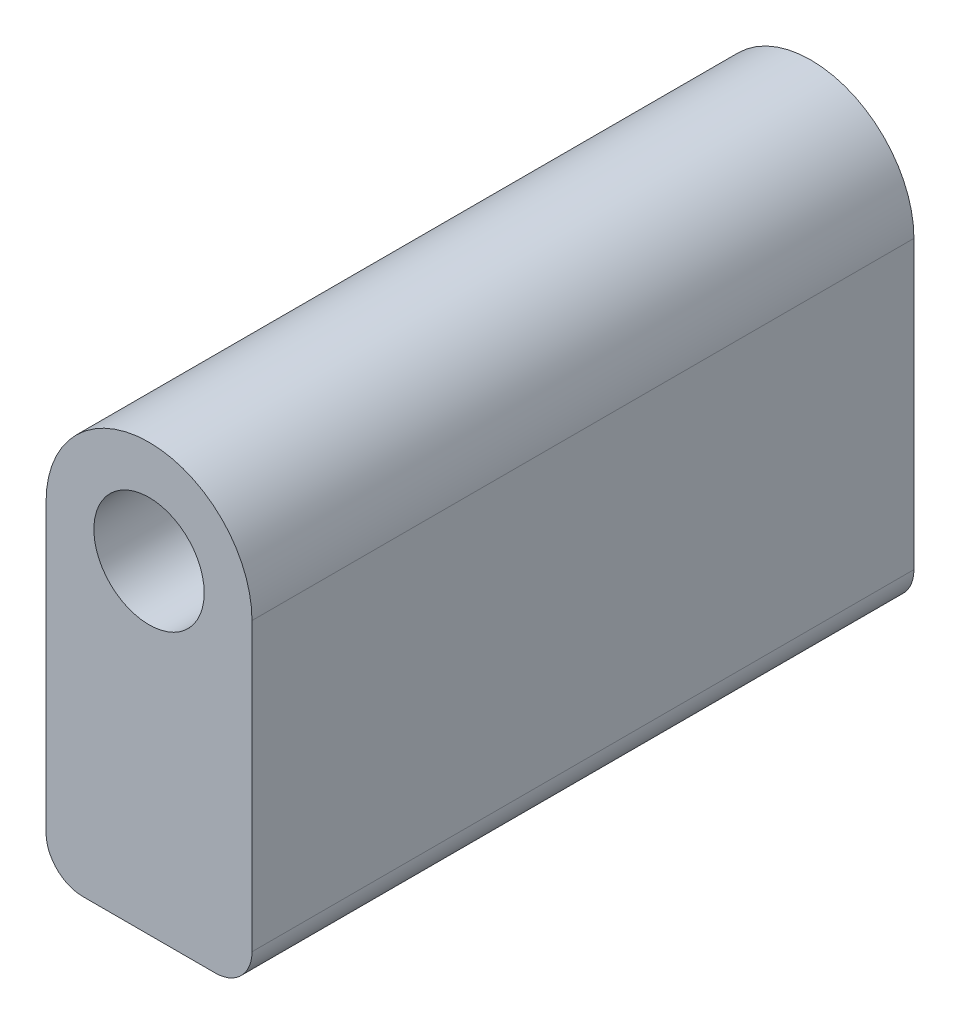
SolidWorks part; units mm, degrees
ref_plane "Front Plane" through (0, 0, 0) normal (0, 0, 1) x (1, 0, 0)
ref_plane "Top Plane" through (0, 0, 0) normal (0, 1, 0) x (1, 0, 0)
ref_plane "Right Plane" through (0, 0, 0) normal (1, 0, 0) x (0, 0, -1)
sketch "Sketch1" plane through (0, 0, 0) normal (0, 0, 1) x (1, 0, 0)
  line L0 (-381, -120.65) -> (-381, -158.75) construction
  line L1 (-363.22, -120.65) -> (-363.22, -158.75)
  line L2 (-398.78, -120.65) -> (-398.78, -158.75)
  line L4 (-398.78, -158.75) -> (-363.22, -158.75)
  line L5 (-398.78, -158.75) -> (-398.78, -176.53)
  line L6 (-398.78, -176.53) -> (-363.22, -176.53)
  line L7 (-363.22, -158.75) -> (-363.22, -176.53)
  line L8 (-398.78, -158.75) -> (-363.22, -176.53) construction
  line L9 (-398.78, -176.53) -> (-363.22, -158.75) construction
  arc A1 (-363.22, -120.65) -> (-398.78, -120.65) centre (-381, -120.65) ccw
  arc A2 (-398.78, -158.75) -> (-363.22, -158.75) centre (-381, -158.75) ccw
  circle A4 centre (-381, -120.65) radius 6.35 construction
  circle A5 centre (-381, -120.65) radius 9.525
  point P0 (-381, -139.7)
  point P14 (-381, -167.64)
  dimension "D1" = 17.78
  dimension "D3" = 3.175
  dimension "D2" = 38.1
extrude "Boss-Extrude1" add sketch "Sketch1" along normal blind 114.3 contours A2 L5 L6 | A2 L6 L7 | L4 A2 | L1 A1 L2 L4 A4
fillet "Fillet1" radius 6.35 2 edges at (-363.22, -176.53, 57.15) (-398.78, -176.53, 57.15)
